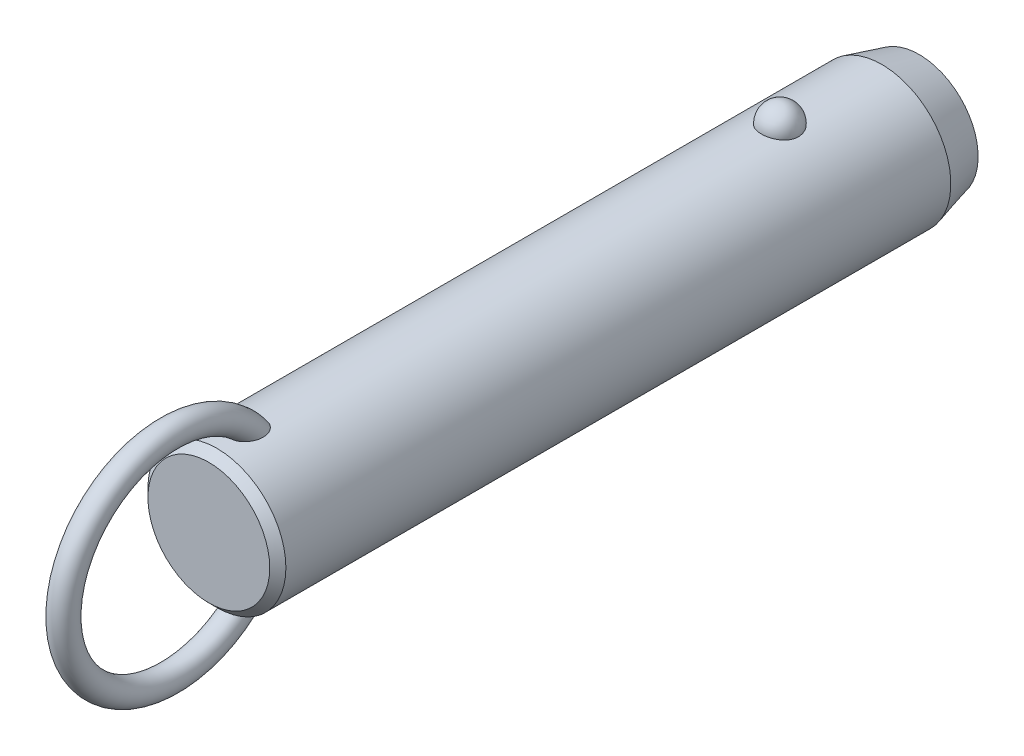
SolidWorks part; units mm, degrees
ref_plane "Front Plane" through (0, 0, 0) normal (0, 0, 1) x (1, 0, 0)
ref_plane "Top Plane" through (0, 0, 0) normal (0, 1, 0) x (1, 0, 0)
ref_plane "Right Plane" through (0, 0, 0) normal (1, 0, 0) x (0, 0, -1)
sketch "Sketch2" plane through (0, 0, 0) normal (0, 0, 1) x (1, 0, 0)
  circle A0 centre (0, 0) radius 11.1
  point P3 (0, 11.1)
  dimension "D1" = 22.2
extrude "Boss-Extrude1" add sketch "Sketch2" along normal blind 76.2
sketch "Sketch3" plane through (0, 0, 0) normal (0, 0, -1) x (-1, 0, 0)
  circle A0 centre (0, 0) radius 11.1
  dimension "D1" = 22.2
extrude "Boss-Extrude2" add sketch "Sketch3" along normal blind 25.4
chamfer "Chamfer1" distance 6 angle 15 1 edges at (-11.1, 0, -25.4)
sketch "Sketch12" plane through (0, 0, 0) normal (1, 0, 0) x (0, 0, -1)
  line L0 (-76.2, 11.1) -> (-76.2, -11.1) construction
  point P0 (-76.2, 0)
sketch "Sketch13" plane through (0, 0, 0) normal (1, 0, 0) x (0, 0, -1)
  circle A0 centre (-95.25, 0) radius 19.05
  point P2 (-76.2, 0)
  dimension "D1" = 38.1
sketch "Sketch14" plane through (0, 0, 0) normal (0, 1, 0) x (1, 0, 0)
  circle A0 centre (0, -78.2) radius 2
  point P2 (0, -76.2)
  dimension "D1" = 4
sweep "Sweep1" add profiles "Sketch14" path "Sketch13"
sketch "Sketch15" plane through (0, 0, 76.2) normal (0, 0, 1) x (1, 0, 0)
  circle A0 centre (0, 0) radius 11.1
  dimension "D1" = 22.2
extrude "Boss-Extrude3" add sketch "Sketch15" along normal blind 12.7
chamfer "Chamfer2" distance 1.3 angle 45 1 edges at (11.1, 0, 88.9)
sketch "Sketch18" plane through (0, 0, 0) normal (1, 0, 0) x (0, 0, -1)
  line L0 (19.4, 11.1) -> (-79.768, 11.1) construction
  line L1 (3, 14.1) -> (3, 8.1)
  line L2 (-79.768, -11.1) -> (19.4, -11.1) construction
  arc A0 (3, 14.1) -> (3, 8.1) centre (3, 11.1) ccw
  point P4 (0, 11.1)
  dimension "D1" = 25.2
revolve "Revolve1" add sketch "Sketch18" angle 360 about L1
